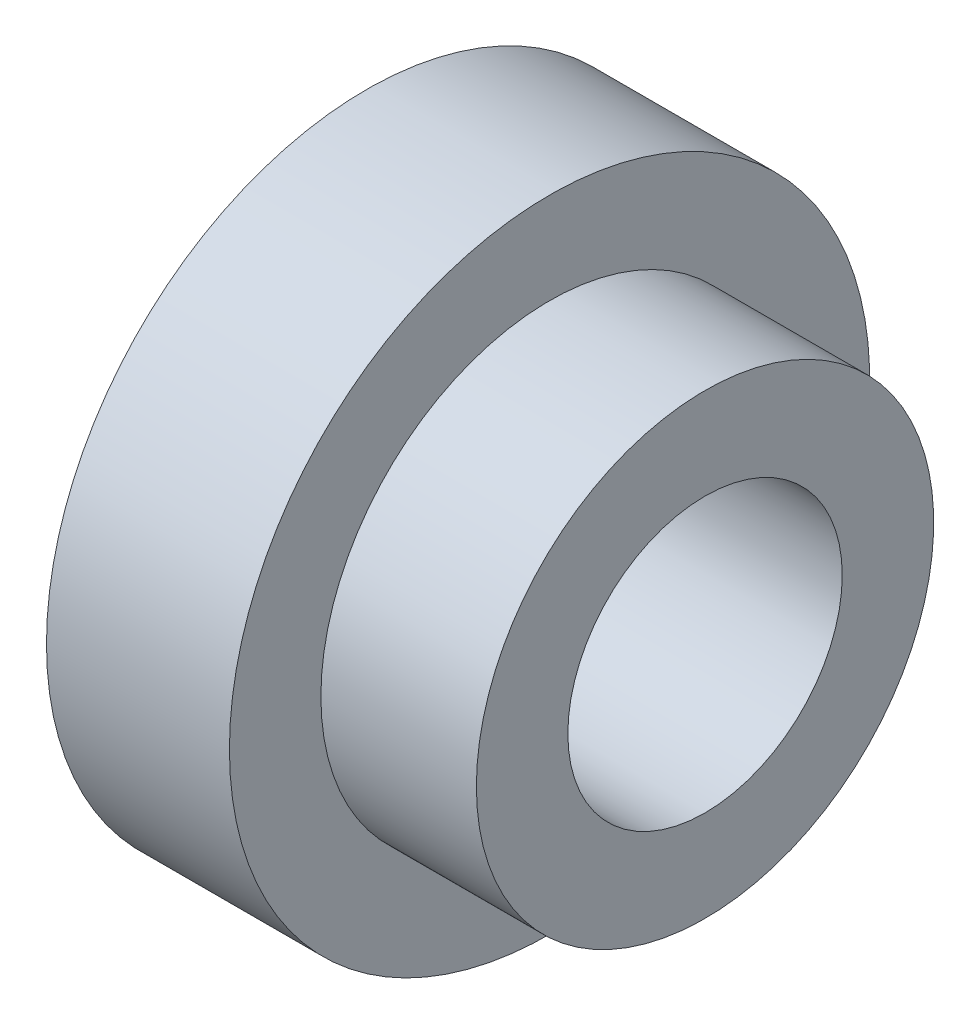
SolidWorks part; units mm, degrees
ref_plane "Front" through (0, 0, 0) normal (0, 0, 1) x (1, 0, 0)
ref_plane "Top" through (0, 0, 0) normal (0, 1, 0) x (1, 0, 0)
ref_plane "Right" through (0, 0, 0) normal (1, 0, 0) x (0, 0, -1)
sketch "Sketch1" plane through (0, 0, 0) normal (0, 1, 0) x (1, 0, 0)
  line L0 (0, 0) -> (7.4, 0)
  line L1 (7.4, 0) -> (7.4, 5)
  line L2 (7.4, 5) -> (4, 5)
  line L3 (4, 5) -> (4, 7)
  line L4 (4, 7) -> (0, 7)
  line L5 (0, 7) -> (0, 0)
  dimension "D1" = 4
  dimension "D2" = 3.4
  dimension "D3" = 7
  dimension "D4" = 5
revolve "Revolve1" add sketch "Sketch1" angle 360 about L0
sketch "Sketch2" plane through (7.4, 0, 0) normal (1, 0, 0) x (0, 0, -1)
  circle A0 centre (0, 0) radius 3
  dimension "D1" = 6
extrude "Cut-Extrude1" cut sketch "Sketch2" against normal through all
